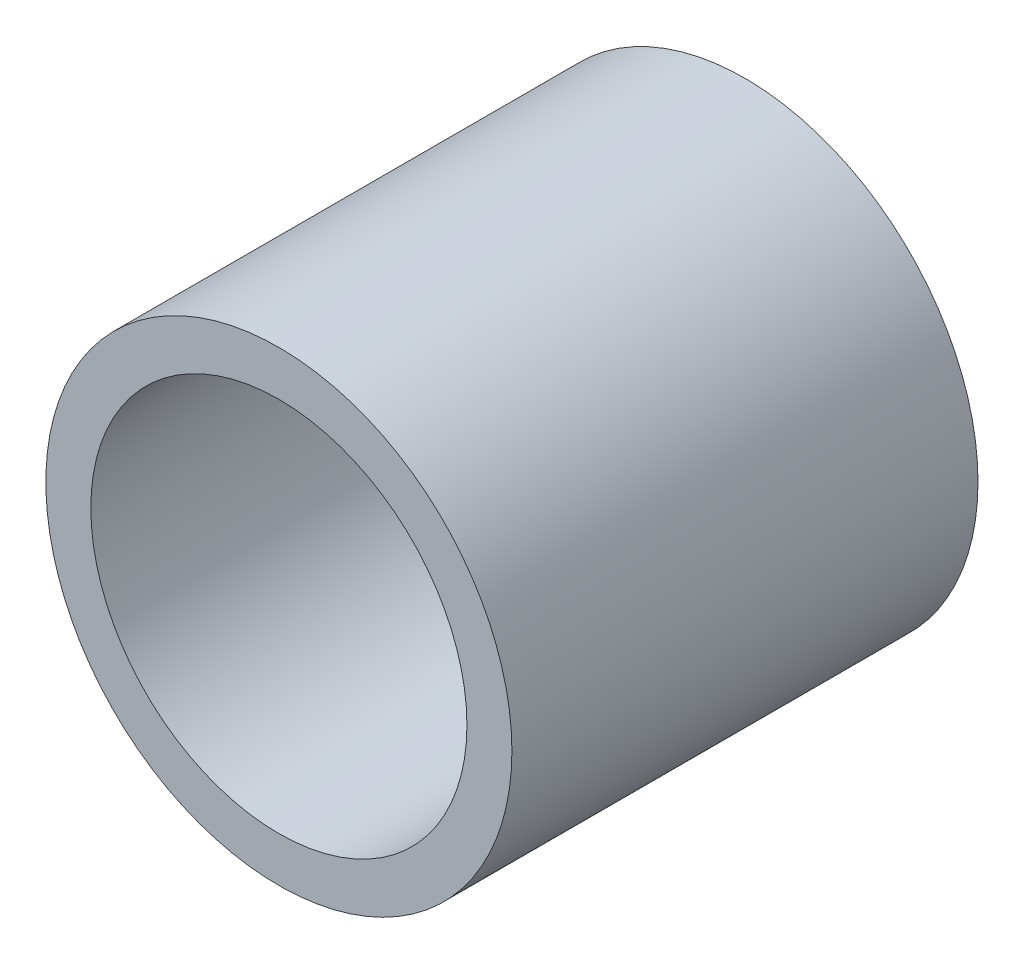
SolidWorks part; units mm, degrees
ref_plane "Спереди" through (0, 0, 0) normal (0, 0, 1) x (1, 0, 0)
ref_plane "Сверху" through (0, 0, 0) normal (0, 1, 0) x (1, 0, 0)
ref_plane "Справа" through (0, 0, 0) normal (1, 0, 0) x (0, 0, -1)
sketch "Эскиз1" plane through (0, 0, 0) normal (0, 0, 1) x (1, 0, 0)
  circle A0 centre (0, 0) radius 4.035
  circle A1 centre (0, 0) radius 5
  dimension "D1" = 10
  dimension "D2" = 8.07
extrude "Бобышка-Вытянуть1" add sketch "Эскиз1" along normal blind 10
